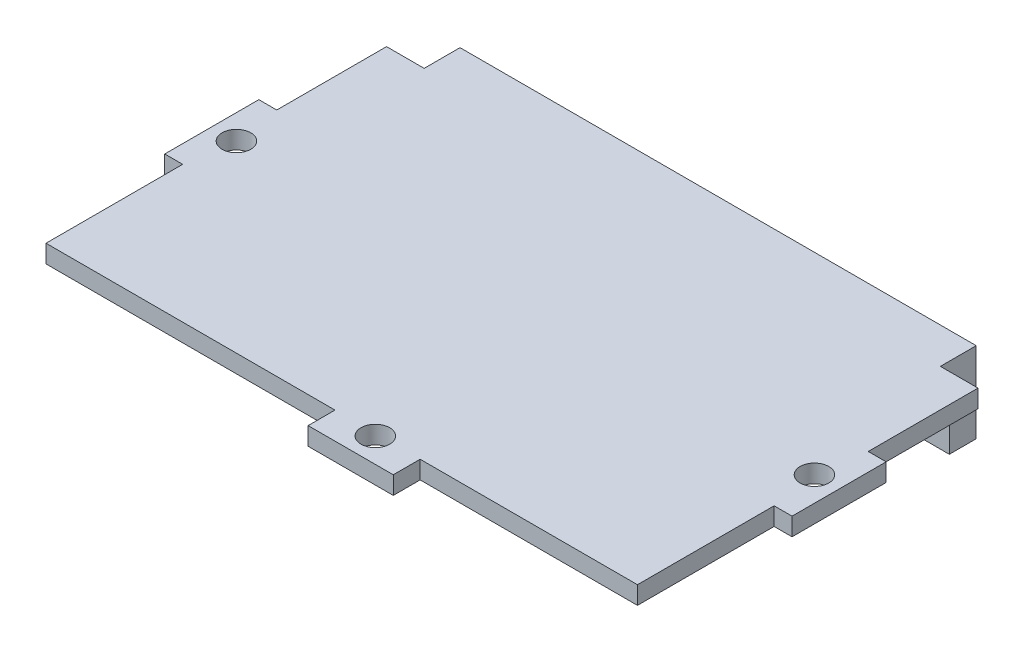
SolidWorks part; units mm, degrees
ref_plane "Front Plane" through (0, 0, 0) normal (0, 0, 1) x (1, 0, 0)
ref_plane "Top Plane" through (0, 0, 0) normal (0, 1, 0) x (1, 0, 0)
ref_plane "Right Plane" through (0, 0, 0) normal (1, 0, 0) x (0, 0, -1)
sketch "Sketch1" plane through (0, 0, 0) normal (0, 1, 0) x (1, 0, 0)
  line L1 (33, -21) -> (-33, -21)
  line L2 (33, -21) -> (33, 21)
  line L3 (33, 21) -> (-33, 21)
  line L4 (-33, -21) -> (-33, 21)
  line L5 (33, -21) -> (-33, 21) construction
  line L6 (33, 21) -> (-33, -21) construction
  point P0 (0, 0)
  dimension "D1" = 66
  dimension "D2" = 42
extrude "Boss-Extrude1" add sketch "Sketch1" along normal blind 2
sketch "Sketch2" plane through (0, 2, 0) normal (0, 1, 0) x (1, 0, 0)
  line L1 (-33, 21) -> (-28.8, 21)
  line L2 (-33, 21) -> (-33, 17)
  line L3 (-33, 17) -> (-28.8, 17)
  line L4 (-28.8, 21) -> (-28.8, 17)
  line L5 (33, 21) -> (28.8, 21)
  line L6 (33, 21) -> (33, 17)
  line L7 (33, 17) -> (28.8, 17)
  line L8 (28.8, 21) -> (28.8, 17)
  dimension "D1" = 4
  dimension "D2" = 4.2
extrude "Cut-Extrude1" cut sketch "Sketch2" against normal through all
sketch "Sketch3" plane through (0, 0, -21) normal (0, 0, -1) x (-1, 0, 0)
  line L1 (-28.8, 0) -> (28.8, 0)
  line L2 (-28.8, 0) -> (-28.8, -7)
  line L3 (-28.8, -7) -> (28.8, -7)
  line L4 (28.8, 0) -> (28.8, -7)
  line L5 (-28.8, 2) -> (28.8, 2) construction
  dimension "D1" = 9
extrude "Boss-Extrude2" add sketch "Sketch3" against normal blind 3
sketch "Sketch5" plane through (0, 0, 0) normal (0, -1, 0) x (1, 0, 0)
  line L0 (35, -4.75) -> (33, -4.75) construction
  line L1 (33, 5.75) -> (35, 5.75) construction
  line L2 (35, 5.75) -> (35, -4.75) construction
  line L3 (35, -4.75) -> (33, -4.75)
  line L4 (33, 5.75) -> (35, 5.75)
  line L5 (35, 5.75) -> (35, -4.75)
  line L6 (0, 0) -> (0, -18) construction
  line L7 (28.8, -18) -> (-28.8, -18) construction
  line L8 (-35, 5.75) -> (-35, -4.75)
  line L9 (-33, 5.75) -> (-35, 5.75)
  line L10 (-35, -4.75) -> (-33, -4.75)
  line L11 (-33, 5.75) -> (33, 5.75)
  line L12 (33, -4.75) -> (-33, -4.75)
  line L14 (-0.75, 24) -> (8.75, 24)
  line L15 (-0.75, 24) -> (-0.75, 7.75)
  line L16 (-0.75, 7.75) -> (8.75, 7.75)
  line L17 (8.75, 7.75) -> (8.75, 24)
  line L18 (-0.75, 24) -> (-0.75, 21) construction
  circle A0 centre (32.25, 0.5) radius 1.6 construction
  circle A1 centre (32.25, 0.5) radius 1.6
  circle A2 centre (-32.25, 0.5) radius 1.6
  circle A3 centre (4, 21.25) radius 1.6 construction
  circle A4 centre (4, 21.25) radius 1.6
  point P25 (8.75, 24)
  point P27 (-0.75, 24)
  dimension "D1" = 2
extrude "Boss-Extrude3" add sketch "Sketch5" against normal up to surface (2 mm away)
sketch "Sketch6" plane through (0, 0, 0) normal (0, -1, 0) x (1, 0, 0)
  circle A0 centre (32.25, 0.5) radius 1.6 construction
  circle A1 centre (-32.25, 0.5) radius 1.6 construction
  circle A2 centre (32.25, 0.5) radius 1.6
  circle A3 centre (-32.25, 0.5) radius 1.6
  circle A4 centre (4, 21.25) radius 1.6 construction
  circle A5 centre (4, 21.25) radius 1.6
extrude "Cut-Extrude2" cut sketch "Sketch6" against normal through all
